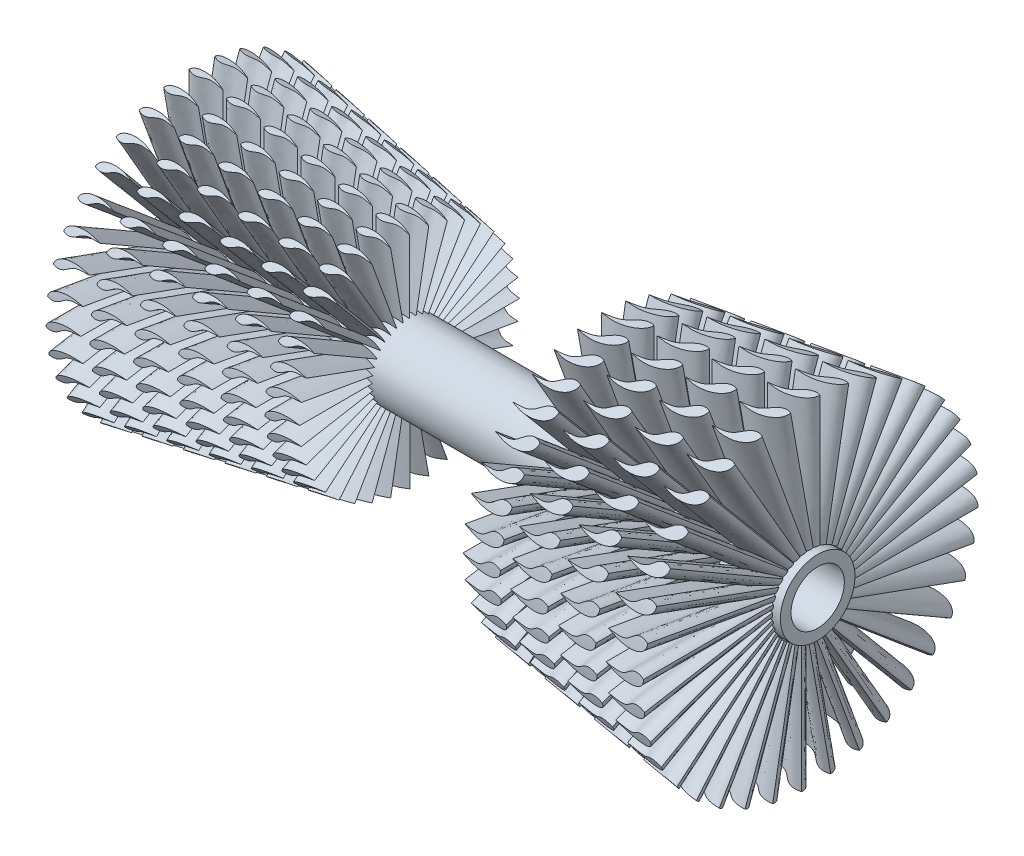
SolidWorks part; units mm, degrees
ref_plane "Front Plane" through (0, 0, 0) normal (0, 0, 1) x (1, 0, 0)
ref_plane "Top Plane" through (0, 0, 0) normal (0, 1, 0) x (1, 0, 0)
ref_plane "Right Plane" through (0, 0, 0) normal (1, 0, 0) x (0, 0, -1)
sketch "Sketch1" plane through (0, 0, 0) normal (0, 0, 1) x (1, 0, 0)
  line L0 (-4137.8179, 0) -> (209103.0772, 0) construction
  line L1 (269.0814, 0) -> (1780.3814, 0)
  line L2 (1780.3814, -88.9) -> (269.0814, -88.9)
  line L3 (1780.3814, -88.9) -> (1780.3814, 0)
  line L5 (129.3814, -970.2694) -> (129.3814, 49029.7306) construction
  line L6 (269.0814, 0) -> (269.0814, -88.9)
  line L15 (1270, -869.1573) -> (1270, 49130.8427) construction
  dimension "D1" = 1511.3
revolve "Revolve1" add sketch "Sketch1" angle 360 about L0
shell "Shell1" thickness 25.4
ref_plane "Plane1" through (0, 88.9, 0) normal (0, 1, 0) x (1, 0, 0)
sketch "Sketch2"
sketch_block_instance "Block1-1"
sketch_block "Block1"
ref_plane "Plane3" through (0, 469.9, 0) normal (0, 1, 0) x (1, 0, 0)
sketch "Sketch13" plane through (0, 469.9, 0) normal (0, 1, 0) x (1, 0, 0)
  line L2 (-1000, 0) -> (49000, 0) construction
  spline S2 degree 5 poles (2172.4395, 614.3205) (-2194.9337, -10.0988) (3090.46, -659.9135) (-2459.5176, 1102.6577) (2837.8788, -1259.1022) (-1236.0976, 1188.2522) knots -1.325146 -1.325146 -1.325146 -1.325146 -1.325146 -1.325146 2.425918 2.425918 2.425918 2.425918 2.425918 2.425918 only from (293.4156, -9.9364) to (364.1931, -0.1326) construction
  spline S3 degree 4 poles (2159.3621, -720.614) (-1796.193, 469.7784) (2370.8819, -262.1219) (-1550.8989, 197.5322) (2348.1608, -251.0059) knots -1.479862 -1.479862 -1.479862 -1.479862 -1.479862 2.707991 2.707991 2.707991 2.707991 2.707991 only from (293.4156, -9.9364) to (364.1931, -0.1326) construction
  spline S4 degree 5 poles (293.4156, -9.9364) (309.0837, -19.7582) (326.2716, -9.9747) (322.5296, 3.2643) (338.397, 2.0973) (364.1931, -0.1326) knots 0 0 0 0 0 0 1 1 1 1 1 1
  spline S5 degree 4 poles (293.4156, -9.9364) (293.3406, 11.3108) (331.8276, 11.3108) (342.6955, 7.3757) (364.1931, -0.1326) knots 0 0 0 0 0 1 1 1 1 1
loft "Loft2" add profiles "Sketch13", "Sketch2"
sketch "Sketch20" plane through (0, 88.9, 0) normal (0, 1, 0) x (1, 0, 0)
  spline S0 degree 5 poles (1368.907, 21.6757) (1344.8527, 34.751) (1320.608, 18.3621) (1327.4883, -1.0452) (1304.0432, -0.9286) (1265.893, -0.2415) knots 0 0 0 0 0 0 1 1 1 1 1 1
  spline S1 degree 4 poles (1368.907, 21.6757) (1371.2319, -10.0793) (1314.6597, -14.0279) (1298.2749, -9.2602) (1265.893, -0.2415) knots 0 0 0 0 0 1 1 1 1 1
  spline S2 degree 5 poles (1500.5466, 21.6757) (1476.4923, 34.751) (1452.2476, 18.3621) (1459.1278, -1.0452) (1435.6827, -0.9286) (1397.5326, -0.2415) knots 0 0 0 0 0 0 1 1 1 1 1 1
  spline S3 degree 4 poles (1500.5466, 21.6757) (1502.8714, -10.0793) (1446.2993, -14.0279) (1429.9144, -9.2602) (1397.5326, -0.2415) knots 0 0 0 0 0 1 1 1 1 1
  spline S4 degree 5 poles (1632.1862, 21.6757) (1608.1319, 34.751) (1583.8872, 18.3621) (1590.7674, -1.0452) (1567.3223, -0.9286) (1529.1722, -0.2415) knots 0 0 0 0 0 0 1 1 1 1 1 1
  spline S5 degree 4 poles (1632.1862, 21.6757) (1634.511, -10.0793) (1577.9389, -14.0279) (1561.554, -9.2602) (1529.1722, -0.2415) knots 0 0 0 0 0 1 1 1 1 1
  spline S6 degree 5 poles (1763.8257, 21.6757) (1739.7715, 34.751) (1715.5267, 18.3621) (1722.407, -1.0452) (1698.9619, -0.9286) (1660.8118, -0.2415) knots 0 0 0 0 0 0 1 1 1 1 1 1
  spline S7 degree 4 poles (1763.8257, 21.6757) (1766.1506, -10.0793) (1709.5785, -14.0279) (1693.1936, -9.2602) (1660.8118, -0.2415) knots 0 0 0 0 0 1 1 1 1 1
  dimension "D1" = 103.014
extrude "Boss-Extrude8" add sketch "Sketch20" along normal blind 508 separate body
sketch "Sketch24" plane through (0, 0, 0) normal (0, 0, 1) x (1, 0, 0)
  line L0 (-1000, 0) -> (49000, 0) construction
  line L1 (-577.5006, 0) -> (-577.5006, 600.71) construction
  line L2 (-577.5006, 600.71) -> (-501.3006, 508) construction
  line L3 (-501.3006, 508) -> (819.4994, 279.4) construction
  line L4 (819.4994, 279.4) -> (2394.2994, 494.4627) construction
  line L5 (2394.2994, 494.4627) -> (2775.2994, 254) construction
  line L6 (2775.2994, 254) -> (2775.2994, 0) construction
  line L8 (819.4994, -720.6) -> (819.4994, 49279.4) construction
  line L10 (819.4994, 269.7866) -> (3242.6915, 600.71)
  line L11 (-818.7037, 543.6019) -> (-818.7037, 1205.8833)
  line L12 (819.4994, 260.0668) -> (819.4994, 269.7866)
  line L13 (-818.7037, 1205.8833) -> (3242.6915, 1181.4502)
  line L14 (3242.6915, 1181.4502) -> (3242.6915, 600.71)
  line L15 (-818.7037, 543.6019) -> (819.4994, 260.0668)
  line L16 (269.0814, 88.9) -> (269.0814, -88.9) construction
  dimension "D1" = 600.71
  dimension "D2" = 76.2
  dimension "D3" = 1320.8
  dimension "D4" = 1574.8
  dimension "D5" = 279.4
  dimension "D6" = 254
  dimension "D7" = 381
  dimension "D8" = 19.05
  dimension "D9" = 19.05
  dimension "D10" = 508
  dimension "D11" = 846.582
sketch "Sketch25" plane through (0, 0, 0) normal (0, 0, 1) x (1, 0, 0)
  line L0 (273.6769, -911.1) -> (273.6769, 49088.9) construction
pattern_linear "LPattern1" count 6 spacing 88.9 along (1, 0, 0)
pattern_circular "CirPattern1" count 36 over 360 about axis through (-4137.8179, 0, 0) along (1, 0, 0)
revolve "Cut-Revolve2" cut sketch "Sketch24" angle 360 about L0
